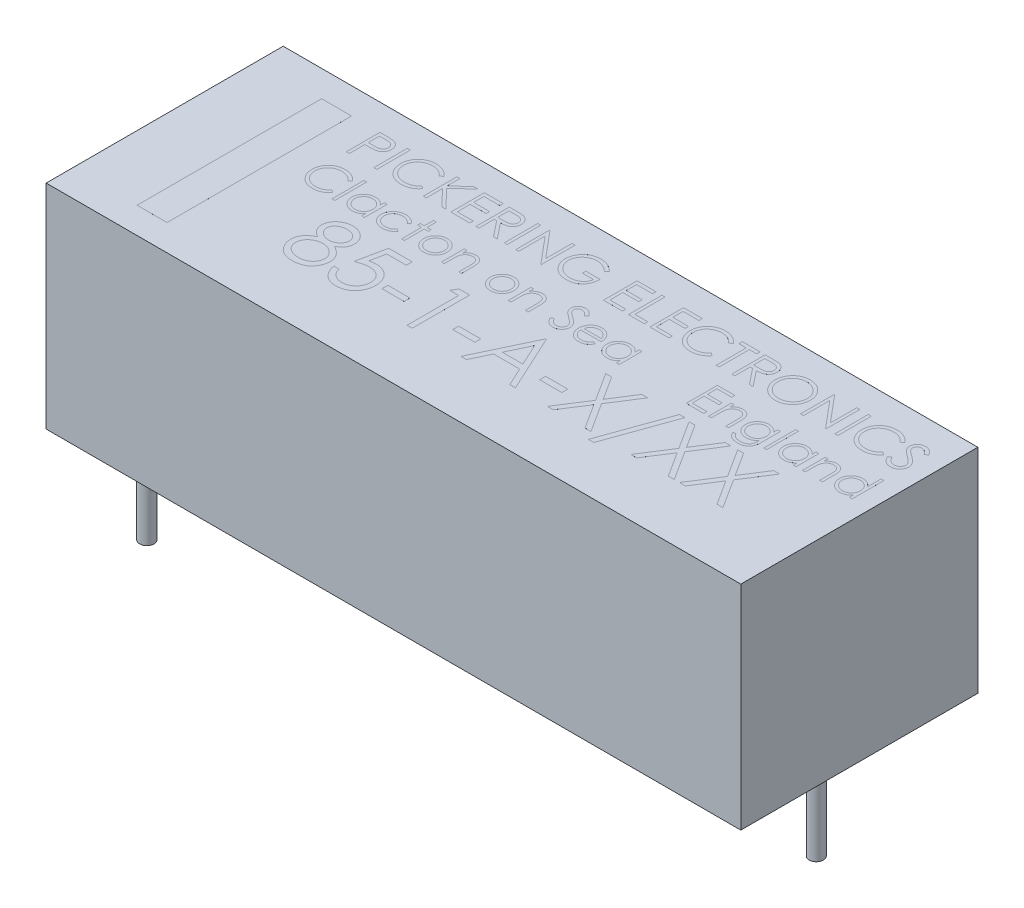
SolidWorks part; units mm, degrees
ref_plane "Front Plane" through (0, 0, 0) normal (0, 0, 1) x (1, 0, 0)
ref_plane "Top Plane" through (0, 0, 0) normal (0, 1, 0) x (1, 0, 0)
ref_plane "Right Plane" through (0, 0, 0) normal (1, 0, 0) x (0, 0, -1)
sketch "Sketch2" plane through (0, 0, 0) normal (0, 1, 0) x (1, 0, 0)
  line L1 (14.5, -4.95) -> (-14.5, -4.95)
  line L2 (14.5, -4.95) -> (14.5, 4.95)
  line L3 (14.5, 4.95) -> (-14.5, 4.95)
  line L4 (-14.5, -4.95) -> (-14.5, 4.95)
  line L5 (14.5, -4.95) -> (-14.5, 4.95) construction
  line L6 (14.5, 4.95) -> (-14.5, -4.95) construction
  point P0 (0, 0)
  dimension "D1" = 9.9
  dimension "D2" = 29
extrude "Main Body" add sketch "Sketch2" along normal blind 8.89 draft 0.023
sketch "Sketch3"
  dimension "D1" = 1.25
  dimension "D2" = 7.7
  dimension "D3" = 1.0965
  dimension "D4" = 2.7
  dimension "D5" = 1.4
  dimension "D6" = 2
extrude "Lettering" add sketch "Sketch3" along normal blind 0.0001
sketch "Sketch4" plane through (0, 0, 0) normal (0, -1, 0) x (1, 0, 0)
  line L0 (-14.5, -4.95) -> (-14.5, 4.95) construction
  line L1 (-12, 4.375) -> (-11.1, 4.375)
  line L2 (-12, 4.375) -> (-12, -4.375)
  line L3 (-12, -4.375) -> (-11.1, -4.375)
  line L4 (-11.1, 4.375) -> (-11.1, -4.375)
  line L5 (-14.5, 4.95) -> (14.5, 4.95) construction
  dimension "D1" = 8.75
  dimension "D2" = 0.9
  dimension "D3" = 2.5
  dimension "D4" = 0.575
extrude "Bobbin feet" add sketch "Sketch4" along normal blind 0.51
sketch "Sketch5" plane through (0, -0.51, 0) normal (0, -1, 0) x (1, 0, 0)
  line L0 (-11.1, -4.375) -> (-11.1, 4.375) construction
  line L1 (-11.1, -2.9375) -> (-12, -2.9375)
  line L2 (-11.1, -2.9375) -> (-11.1, -1.9375)
  line L3 (-11.1, -1.9375) -> (-12, -1.9375)
  line L4 (-12, -2.9375) -> (-12, -1.9375)
  line L5 (-12, 4.375) -> (-12, -4.375) construction
  line L6 (-12, 4.375) -> (-12, -4.375) construction
  line L7 (-12, -0.5) -> (-11.1, -0.5)
  line L8 (-12, -0.5) -> (-12, 0.5)
  line L9 (-12, 0.5) -> (-11.1, 0.5)
  line L10 (-11.1, -0.5) -> (-11.1, 0.5)
  line L11 (-11.1, 1.9375) -> (-12, 1.9375)
  line L12 (-11.1, 1.9375) -> (-11.1, 2.9375)
  line L13 (-11.1, 2.9375) -> (-12, 2.9375)
  line L14 (-12, 1.9375) -> (-12, 2.9375)
  line L15 (-12, -4.375) -> (-11.1, -4.375) construction
  dimension "D1" = 1.4375
  dimension "D2" = 1
  dimension "D3" = 1.4375
  dimension "D4" = 1
  dimension "D5" = 1
  dimension "D6" = 1.4375
extrude "Bobbin feet cut" cut sketch "Sketch5" against normal up to surface (0.51 mm away)
sketch "Sketch8" plane through (0, 0, 0) normal (0, -1, 0) x (1, 0, 0)
  line L0 (-14.5, -4.95) -> (-14.5, 4.95) construction
  line L1 (-12, -4.375) -> (-13.925, -4.375)
  line L2 (-12, -4.375) -> (-12, -2.9375)
  line L3 (-12, -2.9375) -> (-13.925, -2.9375)
  line L4 (-13.925, -4.375) -> (-13.925, -2.9375)
  line L5 (-12, -2.9375) -> (-11.1, -2.9375) construction
  dimension "D1" = 0.575
extrude "Extrude5" add sketch "Sketch8" along normal blind 0.1
pattern_linear "LPattern1" count 4 spacing 2.4385 along (0, 0, 1) of "Extrude5"
mirror "Mirror1" about plane through (0, 0, 0) normal (1, 0, 0) of "Extrude5", "Bobbin feet cut", "Bobbin feet", "LPattern1"
sketch "Sketch9" plane through (0, 0, 0) normal (0, -1, 0) x (1, 0, 0)
  line L1 (14.5, 4.95) -> (14.5, -4.95) construction
  circle A1 centre (12.7, 0) radius 0.2963
  dimension "D4" = 1.8
extrude "Pins" add sketch "Sketch9" along normal blind 4.31
sketch "Sketch10" plane through (0, 0, 0) normal (0, -1, 0) x (1, 0, 0)
  line L0 (14.5, -4.95) -> (-14.5, -4.95) construction
  line L1 (-14.5, -4.95) -> (-14.5, 4.95) construction
  circle A0 centre (-12.7, -2.54) radius 0.3
  circle A1 centre (-12.7, 0) radius 0.3
  circle A2 centre (-12.7, 2.54) radius 0.3
  dimension "D1" = 0.6
  dimension "D2" = 0.6
  dimension "D3" = 0.6
  dimension "D4" = 2.41
  dimension "D5" = 2.54
  dimension "D6" = 2.54
  dimension "D7" = 1.8
extrude "Extrude7" add sketch "Sketch10" along normal blind 4.31
